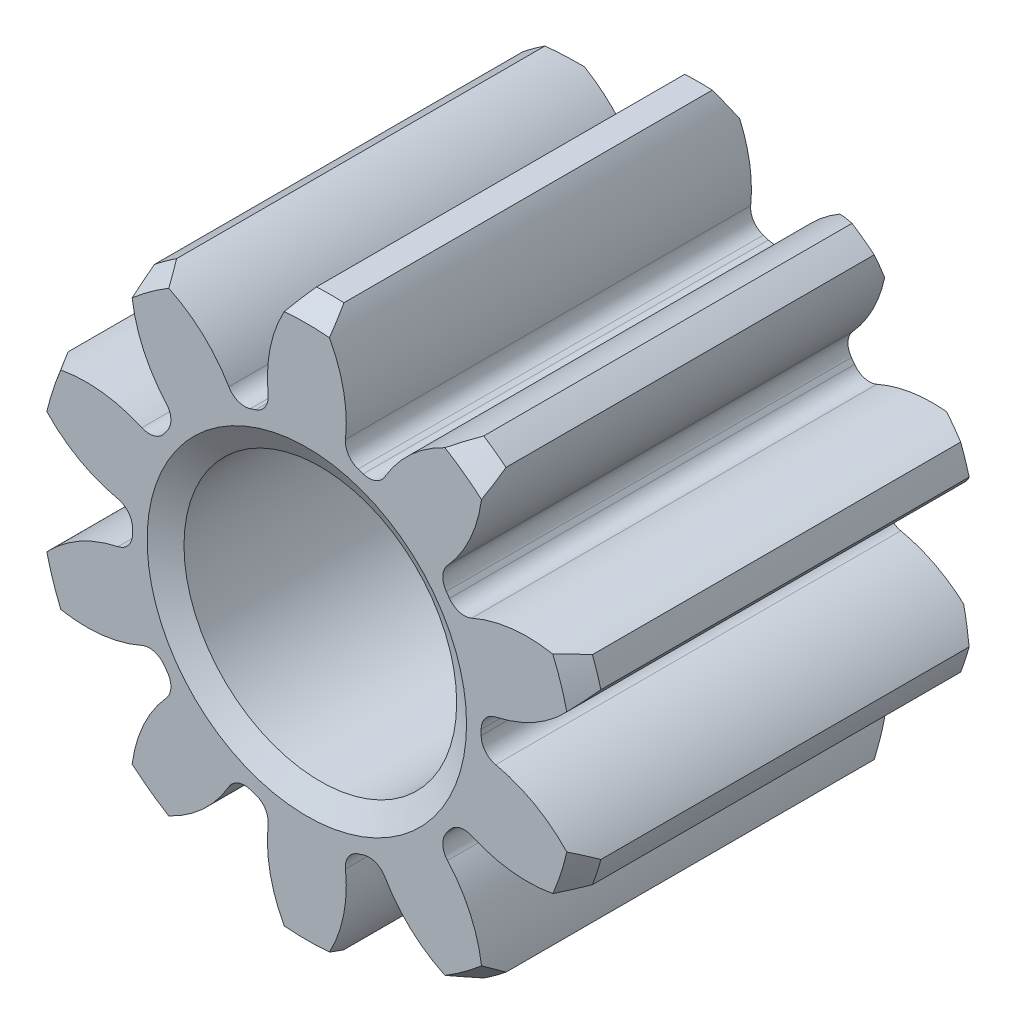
SolidWorks part; units mm, degrees
ref_plane "Front Plane" through (0, 0, 0) normal (0, 0, 1) x (1, 0, 0)
ref_plane "Top Plane" through (0, 0, 0) normal (0, 1, 0) x (1, 0, 0)
ref_plane "Right Plane" through (0, 0, 0) normal (1, 0, 0) x (0, 0, -1)
sketch "Sketch1" plane through (0, 0, 0) normal (0, 0, 1) x (1, 0, 0)
  line L0 (0, 0) -> (0, 1.5) construction
  line L1 (-0.4821, 1.6755) -> (0.4821, 1.3245) construction
  circle A0 centre (0, 0) radius 1.125 construction
  circle A1 centre (0, 0) radius 1.8 construction
  circle A2 centre (0, 0) radius 1.5 construction
  circle A3 centre (0, 0) radius 1.4095 construction
  circle A5 centre (0, 0) radius 0.625 construction
  point P8 (0.15, 0)
  point P13 (5, 0)
sketch "Sketch2" plane through (0, 0, 0) normal (1, 0, 0) x (0, 0, -1)
  line L0 (-1.3, 0) -> (1.3, 0) construction
  line L1 (1.3, 1.8) -> (1.3, -1.8) construction
  line L3 (-1.3, 1.8) -> (1.3, 1.8) construction
  line L5 (-1.3, 12.5) -> (-1.3, -12.5) construction
  point P2 (0, 1.8)
  dimension "Overall Width" = 2.6
  dimension "Face Width" = 1.3
sketch "Sketch3" plane through (0, 0, 0) normal (0, 0, 1) x (1, 0, 0)
  circle A0 centre (0, 0) radius 1.8
  circle A1 centre (0, 0) radius 1.8 construction
extrude "Boss-Extrude1" add sketch "Sketch3" against normal up to vertex (1.3 mm away) and the other way up to vertex (1.3 mm away)
sketch "Sketch5" plane through (0, 0, 0) normal (1, 0, 0) x (0, 0, -1)
  line L1 (-5.9977, 0) -> (8.6948, 0) construction
  line L2 (1.3, 0) -> (-1.3, 0) construction
  line L19 (1.3, -1.8) -> (1.3, 1.8) construction
  line L20 (-1.3, 0) -> (1.3, 0)
  line L21 (-1.3, 0) -> (-1.3, 0.875)
  line L22 (-1.3, 0.875) -> (1.3, 0.875)
  line L23 (1.3, 0) -> (1.3, 0.875)
  line L24 (-1.3, 1.8) -> (-1.3, -1.8) construction
  dimension "D1" = 1.75
revolve "Cut-Revolve1" cut sketch "Sketch5" angle 360 about L1
chamfer "Chamfer1" distance 0.15 angle 30 4 edges at (1.8, 0, -1.3) (0.875, 0, -1.3) (1.8, 0, 1.3) (0.875, 0, 1.3)
sketch "Sketch4" plane through (0, 0, 0) normal (0, 0, 1) x (1, 0, 0)
  line L0 (1.1188, -0.1178) -> (1.1188, 0.1178)
  arc A3 (1.7371, 0.4718) -> (1.7371, -0.4718) centre (0, 0) cw
  circle A4 centre (0, 0) radius 1.8 construction
  arc A5 (1.7371, 0.4718) -> (1.1188, 0.1178) centre (1.0278, 0.9937) cw
  circle A6 centre (0, 0) radius 1.125 construction
  arc A7 (1.7371, -0.4718) -> (1.1188, -0.1178) centre (1.0278, -0.9937) ccw
  spline S0 degree 4 poles (1.3953, 0.1997) (1.396, 0.1998) (1.3978, 0.2002) (1.4012, 0.2009) (1.4067, 0.2023) (1.4137, 0.2044) (1.4226, 0.2074) (1.433, 0.2113) (1.4443, 0.216) (1.4565, 0.2216) (1.4685, 0.2276) (1.4803, 0.2339) (1.4919, 0.2405) (1.5058, 0.2488) (1.5223, 0.2594) (1.5412, 0.2725) (1.5622, 0.2882) (1.583, 0.3051) (1.6032, 0.3225) (1.623, 0.3409) (1.6418, 0.3593) (1.6608, 0.3793) (1.678, 0.3981) (1.6967, 0.4201) (1.7115, 0.4381) (1.7305, 0.4627) (1.7414, 0.4775) (1.754, 0.4952) (1.7594, 0.5032) (1.7628, 0.5081) knots 0 0 0 0 0 0.005377 0.015084 0.028532 0.04661 0.064855 0.092111 0.119476 0.146842 0.174209 0.201575 0.228941 0.256307 0.307035 0.361767 0.4165 0.471232 0.525964 0.580697 0.635429 0.690161 0.744894 0.799626 0.854358 0.909091 0.954545 1 1 1 1 1 construction
  spline S1 degree 4 poles (1.3953, 0.1997) (1.396, 0.1998) (1.3978, 0.2002) (1.4012, 0.2009) (1.4067, 0.2023) (1.4137, 0.2044) (1.4226, 0.2074) (1.433, 0.2113) (1.4443, 0.216) (1.4565, 0.2216) (1.4685, 0.2276) (1.4803, 0.2339) (1.4919, 0.2405) (1.5058, 0.2488) (1.5223, 0.2594) (1.5412, 0.2725) (1.5622, 0.2882) (1.583, 0.3051) (1.6032, 0.3225) (1.623, 0.3409) (1.6418, 0.3593) (1.6608, 0.3793) (1.678, 0.3981) (1.6967, 0.4201) (1.7115, 0.4381) (1.7264, 0.4574) (1.7335, 0.4669) (1.7371, 0.4718) knots 0 0 0 0 0 0.005377 0.015084 0.028532 0.04661 0.064855 0.092111 0.119476 0.146842 0.174209 0.201575 0.228941 0.256307 0.307035 0.361767 0.4165 0.471232 0.525964 0.580697 0.635429 0.690161 0.744894 0.799626 0.854358 0.909091 0.909091 0.909091 0.909091 0.909091 construction
  spline S2 degree 4 poles (1.3953, -0.1997) (1.396, -0.1998) (1.3978, -0.2002) (1.4012, -0.2009) (1.4067, -0.2023) (1.4137, -0.2044) (1.4226, -0.2074) (1.433, -0.2113) (1.4443, -0.216) (1.4565, -0.2216) (1.4685, -0.2276) (1.4803, -0.2339) (1.4919, -0.2405) (1.5058, -0.2488) (1.5223, -0.2594) (1.5412, -0.2725) (1.5622, -0.2882) (1.583, -0.3051) (1.6032, -0.3225) (1.623, -0.3409) (1.6418, -0.3593) (1.6608, -0.3793) (1.678, -0.3981) (1.6967, -0.4201) (1.7115, -0.4381) (1.7305, -0.4627) (1.7414, -0.4775) (1.754, -0.4952) (1.7594, -0.5032) (1.7628, -0.5081) knots 0 0 0 0 0 0.005377 0.015084 0.028532 0.04661 0.064855 0.092111 0.119476 0.146842 0.174209 0.201575 0.228941 0.256307 0.307035 0.361767 0.4165 0.471232 0.525964 0.580697 0.635429 0.690161 0.744894 0.799626 0.854358 0.909091 0.954545 1 1 1 1 1 construction
  spline S3 degree 4 poles (1.3953, -0.1997) (1.396, -0.1998) (1.3978, -0.2002) (1.4012, -0.2009) (1.4067, -0.2023) (1.4137, -0.2044) (1.4226, -0.2074) (1.433, -0.2113) (1.4443, -0.216) (1.4565, -0.2216) (1.4685, -0.2276) (1.4803, -0.2339) (1.4919, -0.2405) (1.5058, -0.2488) (1.5223, -0.2594) (1.5412, -0.2725) (1.5622, -0.2882) (1.583, -0.3051) (1.6032, -0.3225) (1.623, -0.3409) (1.6418, -0.3593) (1.6608, -0.3793) (1.678, -0.3981) (1.6967, -0.4201) (1.7115, -0.4381) (1.7264, -0.4574) (1.7335, -0.4669) (1.7371, -0.4718) knots 0 0 0 0 0 0.005377 0.015084 0.028532 0.04661 0.064855 0.092111 0.119476 0.146842 0.174209 0.201575 0.228941 0.256307 0.307035 0.361767 0.4165 0.471232 0.525964 0.580697 0.635429 0.690161 0.744894 0.799626 0.854358 0.909091 0.909091 0.909091 0.909091 0.909091 construction
extrude "Cut-Extrude1" cut sketch "Sketch4" against normal through all both and the other way through all
fillet "Fillet1" radius 0.1178 2 edges at (1.1188, -0.1178, 0) (1.1188, 0.1178, 0)
pattern_circular "CirPattern1" count 10 over 360 about axis through (0, 0, 0) along (0, 0, 1) of "Cut-Extrude1", "Fillet1"
equation "\"Number of Teeth\"= 10"
equation "\"Module\"= 0.3"
equation "\"Diametral Pitch\"= 1 / \"Module\""
equation "\"Dedendum\"= 1.25 / \"Diametral Pitch\""
equation "\"Pitch Diameter\"= \"Module\" * \"Number of Teeth\""
equation "\"Root Diameter\"= \"Pitch Diameter\" - ( 2 * \"Dedendum\" )"
equation "\"Root Diameter@Sketch1\"=\"Root Diameter\""
equation "\"OD@Sketch1\" = \"Outside Diameter\""
equation "\"D1@CirPattern1\"=\"Number of Teeth\""
equation "\"Pressure Angle\"= 20"
equation "\"Base Diameter\"= \"Pitch Diameter\" * cos ( \"Pressure Angle\" )"
equation "\"Outside Diameter\"= ( \"Number of Teeth\" + 2 ) / \"Diametral Pitch\""
equation "\"Pitch Angle\"= 360deg / \"Number of Teeth\""
equation "\"Alpha\"= sqr ( \"Pitch Diameter\" ^ 2 - \"Base Diameter\" ^ 2 ) / \"Base Diameter\" * 180 / PI - \"Pressure Angle\""
equation "\"Beta\"= ( \"Pitch Angle\" / 4 - \"Alpha\" )"
equation "\"Phi\"= sqr ( ( \"Outside Diameter\" / 2 ) ^ 2 - ( \"Base Diameter\" / 2 ) ^ 2 ) / ( \"Base Diameter\" / 2 )"
equation "\"Addendum\"= 1 / \"Diametral Pitch\""
equation "\"WorkingDepth\"= 2 / \"Diametral Pitch\""
equation "\"WholeDepth\"= 2.25 / \"Diametral Pitch\""
equation "\"Clearance\"= 0.25 / \"Diametral Pitch\""
equation "\"ToothThickness\"= ( pi * 2 ) / \"Diametral Pitch\""
equation "\"CircularPitch\"= pi / \"Diametral Pitch\""
equation "\"Number of Teeth@Sketch1\"=\"Number of Teeth\""
equation "\"Module@Sketch1\"=\"Module\""
equation "\"Pressure Angle@Sketch1\"=\"Pressure Angle\""
equation "\"Gear Pitch Diameter@Sketch1\"=\"Pitch Diameter\""
equation "\"Base Diameter@Sketch1\"=\"Base Diameter\""
equation "\"Fillet\"= \"Clearance\" * cos ( \"Pressure Angle\" ) * tan ( ( 90 + \"Pressure Angle\" ) / 2 )"
equation "\"D1\"= \"Fillet\""
equation "\"D1\"= \"Set Screw Pitch@Sketch1\" * .75"
equation "\"D1\"= \"Set Screw Diameter@Sketch1\" / 2"
equation "\"D3\"= \"Set Screw Pitch@Sketch1\" +  ( \"Hub Diameter@Sketch1\" / 2 ) "
equation "\"D4\"= \"Set Screw Pitch@Sketch1\""
equation "\"D2\"= \"Fillet\" * 2"
equation "\"D1\"= \"Fillet\" * 2"
equation "\"D1@Chamfer2\"=\"Fillet\""
equation "\"D1@Sketch4\"=\"CircularPitch\"*0.25"
equation "\"D1@Fillet1\"=\"CircularPitch\"*0.125"
